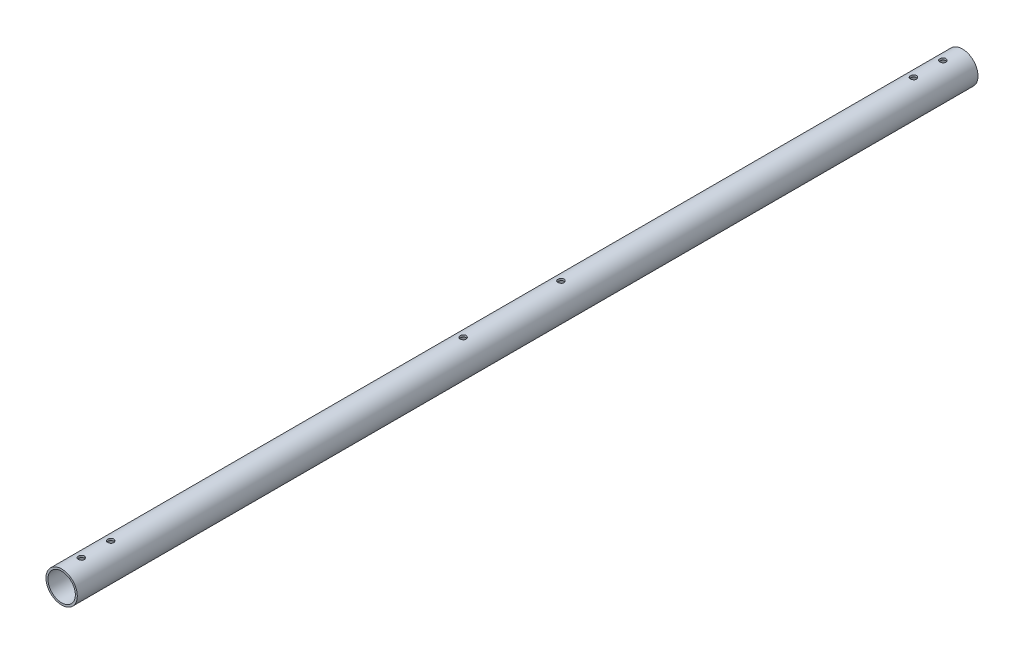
SolidWorks part; units mm, degrees
ref_plane "前视基准面" through (0, 0, 0) normal (0, 0, 1) x (1, 0, 0)
ref_plane "上视基准面" through (0, 0, 0) normal (0, 1, 0) x (1, 0, 0)
ref_plane "右视基准面" through (0, 0, 0) normal (1, 0, 0) x (0, 0, -1)
other "Configuration Table"
sketch "草图1" plane through (0, 0, 0) normal (0, 0, 1) x (1, 0, 0)
  circle A0 centre (0, 0) radius 8
  circle A1 centre (0, 0) radius 7
extrude "凸台-拉伸1" add sketch "草图1" along normal blind 460
ref_point "点1"
ref_plane "基准面1" through (0, 0, 0) normal (0, 1, 0) x (1, 0, 0)
sketch "草图2" plane through (0, 0, 0) normal (0, 1, 0) x (1, 0, 0)
  line L0 (0, 0) -> (0, -460) construction
  line L1 (-8, -460) -> (8, -460) construction
  line L2 (8, 0) -> (-8, 0) construction
  circle A0 centre (0, -10) radius 1.55
  circle A1 centre (0, -25) radius 1.55
  circle A2 centre (0, -450) radius 1.55
  circle A3 centre (0, -435) radius 1.55
  circle A7 centre (0, -205) radius 1.55
  circle A8 centre (0, -255) radius 1.55
  dimension "D3" = 10
  dimension "D5" = 205
  dimension "D6" = 205
  dimension "D1" = 10
  dimension "D2" = 15
  dimension "D4" = 15
extrude "切除-拉伸1" cut sketch "草图2" against normal through all and the other way through all
